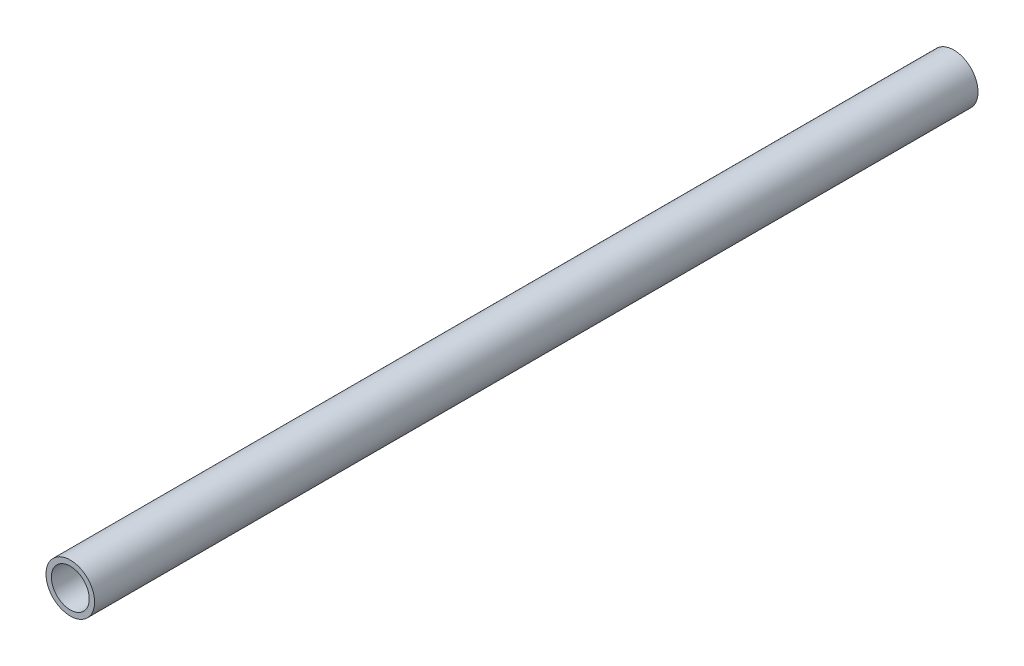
SolidWorks part; units mm, degrees
ref_plane "Plane1" through (0, 0, 0) normal (0, 0, 1) x (1, 0, 0)
ref_plane "Plane2" through (0, 0, 0) normal (0, 1, 0) x (1, 0, 0)
ref_plane "Plane3" through (0, 0, 0) normal (1, 0, 0) x (0, 0, -1)
sketch "Sketch1" plane through (0, 0, 0) normal (0, 0, 1) x (1, 0, 0)
  circle A0 centre (0, 0) radius 13.081
  circle A1 centre (0, 0) radius 16.764
  dimension "D1" = 33.528
  dimension "D2" = 26.162
extrude "Base-Extrude" add sketch "Sketch1" along normal mid plane 609.6
